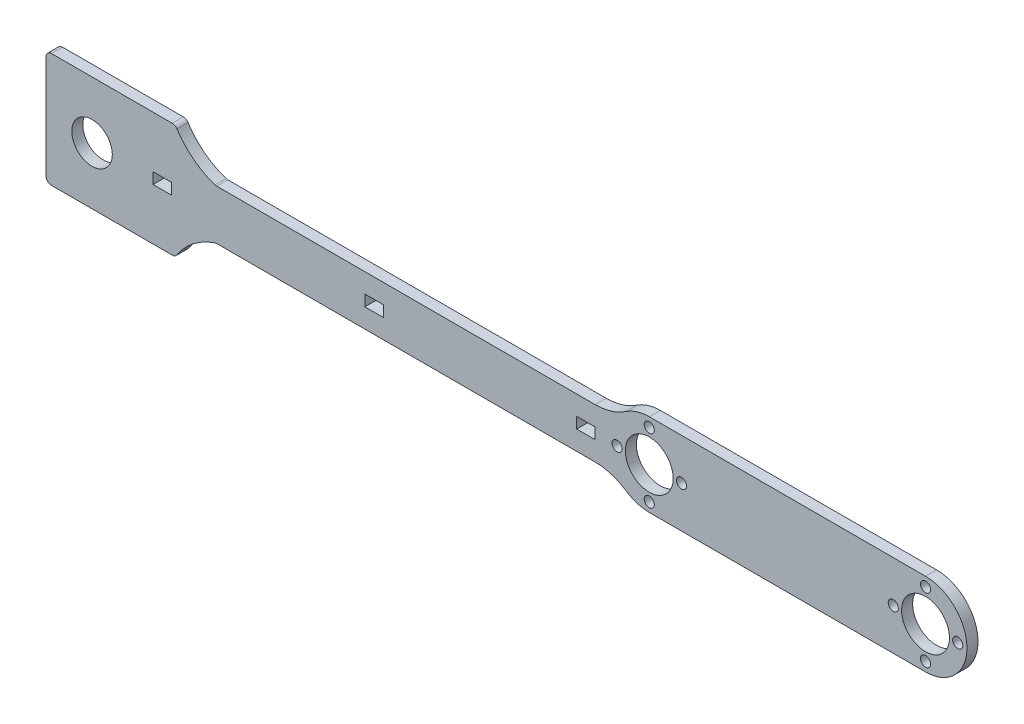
SolidWorks part; units mm, degrees
ref_plane "Front Plane" through (0, 0, 0) normal (0, 0, 1) x (1, 0, 0)
ref_plane "Top Plane" through (0, 0, 0) normal (0, 1, 0) x (1, 0, 0)
ref_plane "Right Plane" through (0, 0, 0) normal (1, 0, 0) x (0, 0, -1)
sketch "Sketch1" plane through (0, 0, 0) normal (0, 0, 1) x (1, 0, 0)
  line L0 (-1000, 0) -> (49000, 0) construction
  line L1 (-250, 22.5) -> (-250, 31)
  line L2 (-250, 22.5) -> (-250, 21)
  line L3 (77.5278, 22.5) -> (227.5278, 22.5)
  line L4 (250, 54.0543) -> (250, -56.2897) construction
  line L5 (-250, 22.5) -> (250, -22.5) construction
  line L6 (-250, -22.5) -> (250, 22.5) construction
  line L7 (0, -1000) -> (0, 49000) construction
  line L8 (48.1339, 44.2953) -> (48.1339, -71.2953) construction
  line L13 (-250, -21) -> (-250, -31)
  line L14 (77.5278, -22.5) -> (227.5278, -22.5)
  line L15 (-250, -31) -> (-200, -31)
  line L16 (-225, 42.6192) -> (-225, -104.6192) construction
  line L17 (-307.2868, -26) -> (-192.7132, -26) construction
  line L18 (-157, 22.5) -> (-157, -33.9985) construction
  line L19 (227.5278, 22.5) -> (227.5278, -36.2084) construction
  line L20 (227.5278, 22.5) -> (77.5278, 22.5) construction
  line L21 (227.5278, -36.2084) -> (77.5278, -36.2084) construction
  line L22 (77.5278, 22.5) -> (77.5278, -36.2084) construction
  line L23 (152.5278, 34.6489) -> (152.5278, -107.0658) construction
  line L24 (77.5278, 22.5) -> (77.5278, -36.2084) construction
  line L25 (-250, 31) -> (-200, 31)
  line L26 (48.1339, 13.5) -> (-157.7658, 13.5)
  line L27 (48.1339, -13.5) -> (-157.7658, -13.5)
  line L28 (48.1339, 3) -> (48.1339, -3) construction
  line L29 (48.1339, 3) -> (-191.8661, 3) construction
  line L30 (48.1339, -3) -> (-191.8661, -3) construction
  line L31 (-191.8661, 3) -> (-191.8661, -3) construction
  line L32 (-191.8661, 3) -> (-191.8661, -3)
  line L33 (-191.8661, 3) -> (-181.8661, 3)
  line L34 (-191.8661, -3) -> (-181.8661, -3)
  line L35 (-181.8661, 3) -> (-181.8661, -3)
  line L36 (-71.8661, 49.3692) -> (-71.8661, -43.3692) construction
  line L37 (38.1339, 3) -> (38.1339, -3)
  line L38 (-76.8661, 3) -> (-66.8661, 3)
  line L39 (-76.8661, 3) -> (-76.8661, -3)
  line L40 (-76.8661, -3) -> (-66.8661, -3)
  line L41 (-66.8661, 3) -> (-66.8661, -3)
  line L42 (-76.8661, 3) -> (-66.8661, -3) construction
  line L43 (-76.8661, -3) -> (-66.8661, 3) construction
  line L44 (48.1339, -3) -> (38.1339, -3)
  line L45 (48.1339, 3) -> (48.1339, -3)
  line L46 (48.1339, 3) -> (38.1339, 3)
  line L47 (-179.7627, 71.1048) -> (-179.7627, -31.4888) construction
  line L48 (-200, 31) -> (-179.7627, 31)
  line L49 (-200, -31) -> (-179.7627, -31)
  line L54 (-250, 21) -> (-250, -21)
  circle A0 centre (-225, 0) radius 11
  arc A1 (227.5278, -22.5) -> (227.5278, 22.5) centre (227.5278, 0) ccw
  circle A2 centre (227.5278, 0) radius 17.5 construction
  circle A3 centre (227.5278, 0) radius 13
  circle A4 centre (227.5278, -17.5) radius 2.75
  circle A5 centre (210.0278, 0) radius 2.75
  circle A6 centre (227.5278, 17.5) radius 2.75
  circle A7 centre (245.0278, 0) radius 2.75
  circle A8 centre (77.5278, 0) radius 17.5 construction
  circle A9 centre (60.0278, 0) radius 2.75
  circle A10 centre (77.5278, 0) radius 13
  circle A11 centre (77.5278, -17.5) radius 2.75
  circle A12 centre (95.0278, 0) radius 2.75
  circle A13 centre (77.5278, 17.5) radius 2.75
  arc A14 (77.5278, -22.5) -> (64.9304, -18.6429) centre (77.5278, 0) cw
  arc A15 (-179.7627, 31) -> (-157.7658, 13.5) centre (-145.7439, 51.1858) ccw
  arc A16 (64.9304, 18.6429) -> (77.5278, 22.5) centre (77.5278, 0) cw
  arc A18 (-179.7627, -31) -> (-157.7658, -13.5) centre (-145.7439, -51.1858) cw
  arc A19 (64.9304, -18.6429) -> (48.1339, -13.5) centre (48.1339, -43.5) ccw
  arc A20 (48.1339, 13.5) -> (64.9304, 18.6429) centre (48.1339, 43.5) ccw
  point P0 (0, 0)
  point P20 (-225, -31)
  point P23 (-250, -26)
  point P28 (-250, -26)
  point P35 (250, -1.1177)
  point P41 (152.5278, -36.2084)
  point P54 (227.5278, 0)
  point P76 (59.5278, 13.5)
  point P80 (48.1339, -13.5)
  point P81 (-71.8661, 0)
  point P90 (-71.8661, 3)
  dimension "D10" = 26
  dimension "D11" = 35
  dimension "D12" = 5.5
  dimension "D15" = 30
  dimension "D4" = 22
  dimension "D1" = 500
  dimension "D2" = 45
  dimension "D3" = 25
  dimension "D5" = 10
  dimension "D8" = 45
  dimension "D9" = 150
  dimension "D14" = 27
  dimension "D16" = 240
  dimension "D17" = 6
  dimension "D18" = 10
  dimension "D19" = 10
  dimension "D13" = 4
extrude "Boss-Extrude2" add sketch "Sketch1" along normal blind 6 contours A0
fillet "Fillet1" radius 3 6 edges at (-157.7658, 13.5, 3) (-157.7658, -13.5, 3) (-179.7627, -31, 3) (-250, -31, 3) (-179.7627, 31, 3) (-250, 31, 3)
